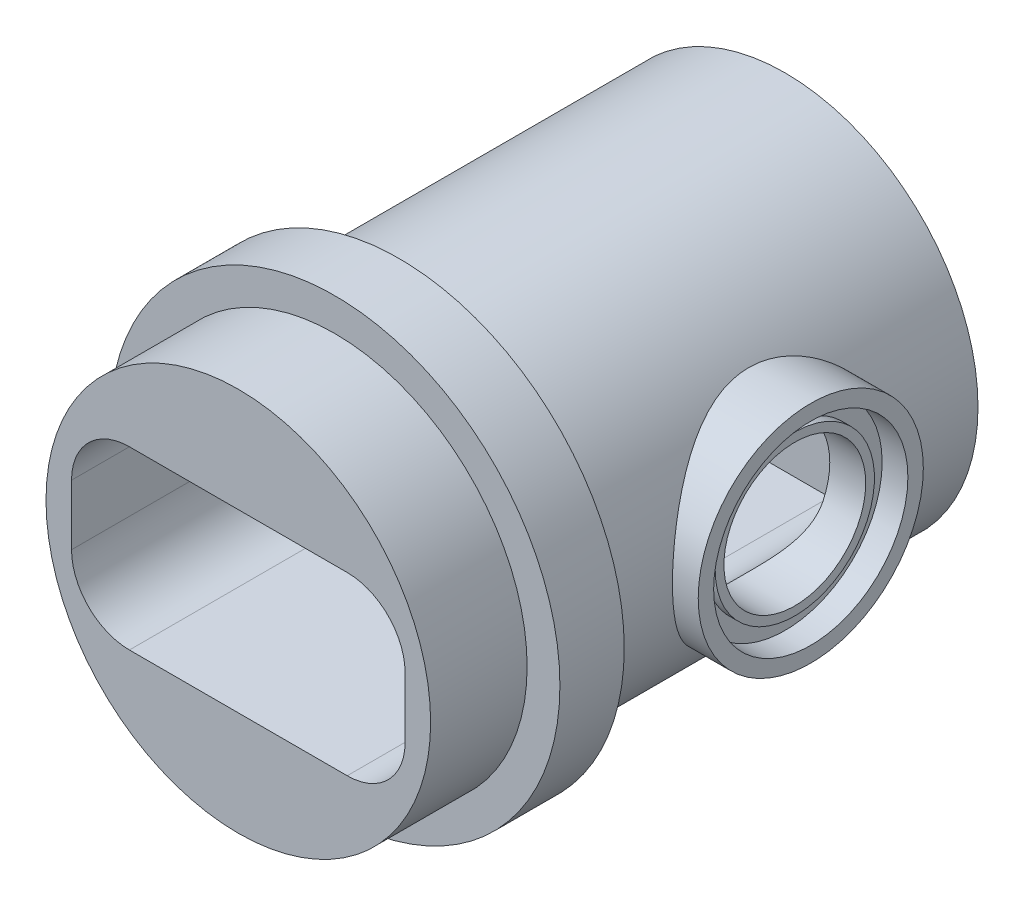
SolidWorks part; units mm, degrees
ref_plane "Front Plane" through (0, 0, 0) normal (0, 0, 1) x (1, 0, 0)
ref_plane "Top Plane" through (0, 0, 0) normal (0, 1, 0) x (1, 0, 0)
ref_plane "Right Plane" through (0, 0, 0) normal (1, 0, 0) x (0, 0, -1)
sketch "Sketch2" plane through (0, 0, 0) normal (0, 0, 1) x (1, 0, 0)
  circle A0 centre (0, 0) radius 38.1
  dimension "D1" = 76.2
extrude "Boss-Extrude1" add sketch "Sketch2" along normal blind 76.2
ref_plane "Plane1" through (43.18, 0, 0) normal (1, 0, 0) x (0, 0, -1)
sketch "Sketch6" plane through (0, 0, 76.2) normal (0, 0, 1) x (1, 0, 0)
  circle A0 centre (0, 0) radius 44.45
  dimension "D1" = 88.9
extrude "Boss-Extrude3" add sketch "Sketch6" along normal blind 12.7
sketch "Sketch7" plane through (0, 0, 88.9) normal (0, 0, 1) x (1, 0, 0)
  circle A0 centre (0, 0) radius 37.973
  dimension "D1" = 75.946
extrude "Boss-Extrude4" add sketch "Sketch7" along normal blind 19.05
sketch "Sketch9" plane through (43.18, 0, 0) normal (1, 0, 0) x (0, 0, -1)
  line L0 (0, -38.1) -> (0, 38.1) construction
  circle A0 centre (-38.1, 0) radius 22.225
  dimension "D1" = 44.45
  dimension "D2" = 38.1
extrude "Boss-Extrude5" add sketch "Sketch9" against normal blind 15.24
sketch "Sketch8" plane through (0, 0, 107.95) normal (0, 0, 1) x (1, 0, 0)
  line L11 (32.9325, -17.375) -> (-32.9325, -17.375)
  line L12 (32.9325, -17.375) -> (32.9325, 17.375)
  line L13 (32.9325, 17.375) -> (-32.9325, 17.375)
  line L14 (-32.9325, -17.375) -> (-32.9325, 17.375)
  line L15 (32.9325, -17.375) -> (-32.9325, 17.375) construction
  line L16 (32.9325, 17.375) -> (-32.9325, -17.375) construction
  point P0 (0, 0)
  dimension "D2" = 65.865
  dimension "D1" = 34.75
extrude "Cut-Extrude3" cut sketch "Sketch8" against normal offset from surface (95.25 mm away) 12.7
fillet "Fillet2" radius 11.43 4 edges at (32.9325, 17.375, 60.325) (-32.9325, 17.375, 60.325) (-32.9325, -17.375, 60.325) (32.9325, -17.375, 60.325)
sketch "Sketch10" plane through (43.18, 0, 0) normal (1, 0, 0) x (0, 0, -1)
  circle A0 centre (-38.1, 0) radius 14
  dimension "D1" = 28
extrude "Cut-Extrude5" cut sketch "Sketch10" against normal blind 31.242
sketch "Sketch11" plane through (43.18, 0, 0) normal (1, 0, 0) x (0, 0, -1)
  circle A0 centre (-38.1, 0) radius 19.177
  dimension "D1" = 38.354
extrude "Cut-Extrude6" cut sketch "Sketch11" against normal blind 5.08
sketch "Sketch12" plane through (38.1, 0, 0) normal (1, 0, 0) x (0, 0, -1)
  circle A0 centre (-38.1, 0) radius 14
  circle A1 centre (-38.1, 0) radius 15.7226
  circle A2 centre (-38.1, 0) radius 19.177 construction
  dimension "D1" = 3.4544
extrude "Boss-Extrude6" add sketch "Sketch12" along normal blind 1.9304
